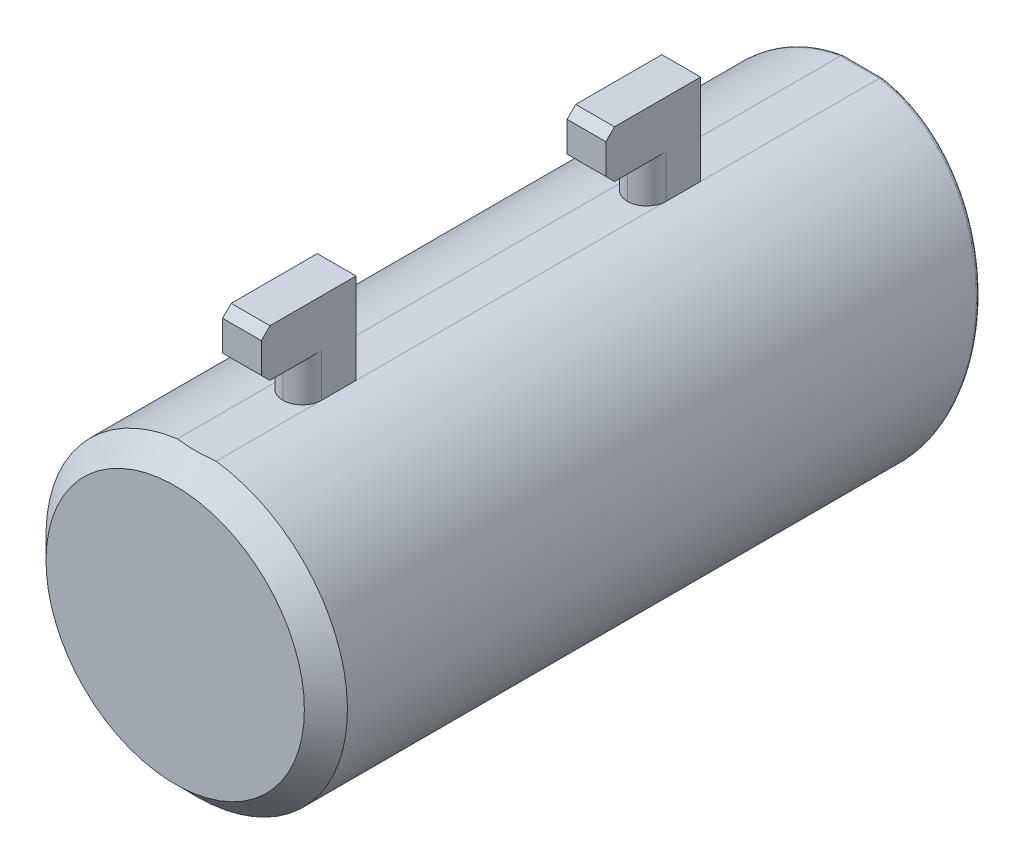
SolidWorks part; units mm, degrees
ref_plane "Спереди" through (0, 0, 0) normal (0, 0, 1) x (1, 0, 0)
ref_plane "Сверху" through (0, 0, 0) normal (0, 1, 0) x (1, 0, 0)
ref_plane "Справа" through (0, 0, 0) normal (1, 0, 0) x (0, 0, -1)
sketch "Эскиз2" plane through (0, 0, 0) normal (0, 0, 1) x (1, 0, 0)
  circle A0 centre (0, 0) radius 17.5
extrude "Бобышка-Вытянуть1" add sketch "Эскиз2" against normal blind 80
chamfer "Фаска1" distance 2.5 angle 45 1 edges at (17.5, 0, 0)
shell "Оболочка1" thickness 2.5
sketch "Эскиз12" plane through (0, 0, 0) normal (0, 0, 1) x (1, 0, 0)
  line L0 (-2.25, 17.3548) -> (2.25, 17.3548)
  arc A0 (2.25, 17.3548) -> (-2.25, 17.3548) centre (0, 0) ccw
  circle A1 centre (0, 0) radius 17.5 construction
extrude "Вырез-Вытянуть5" cut sketch "Эскиз12" against normal up to surface (80 mm away)
sketch "Эскиз11" plane through (0, 0, 0) normal (1, 0, 0) x (0, 0, -1)
  line L0 (70.6607, -17.5) -> (80, 17.3548)
  line L2 (80, 17.3548) -> (80, -17.5)
  line L3 (80, -17.5) -> (70.6607, -17.5)
extrude "Вырез-Вытянуть4" cut sketch "Эскиз11" against normal through all both and the other way through all
fillet "Скругление2" radius 0.4 3 edges at (0, -17.5, -70.6607) (0, -15, -71.3306) (0, 17.3548, -80)
sketch "Эскиз15" plane through (0, 0, 0) normal (1, 0, 0) x (0, 0, -1)
  line L0 (19.75, 17.3548) -> (12.5, 17.3548)
  line L1 (79.4787, 17.3548) -> (2.5, 17.3548) construction
  line L2 (12.5, 17.3548) -> (12.5, 22.3548)
  line L3 (12.5, 22.3548) -> (7.75, 22.3548)
  line L4 (7.75, 22.3548) -> (7.75, 27.8548)
  line L5 (7.75, 27.8548) -> (19.75, 27.8548)
  line L6 (19.75, 27.8548) -> (19.75, 17.3548)
  line L7 (0, 15) -> (0, -15) construction
  line L8 (73.9231, -5.3244) -> (80, 17.3548) construction
  line L9 (70.7401, -17.2035) -> (79.8651, 16.8512) construction
  line L10 (12.5, 17.3548) -> (80, 17.3548) construction
extrude "Бобышка-Вытянуть3" add sketch "Эскиз15" along normal mid plane 4.5
fillet "Скругление5" radius 2.25 2 edges at (2.25, 19.8548, -12.5) (-2.25, 19.8548, -12.5)
chamfer "Фаска2" distance 1 angle 45 5 edges at (0, 22.3548, -7.75) (0, 27.8548, -7.75) (2.25, 22.6048, -19.75) (0, 27.8548, -19.75) (-2.25, 22.6048, -19.75)
pattern_linear "Линейный массив2" count 2 spacing 40 along (0, 0, -1) of "Бобышка-Вытянуть3", "Скругление5", "Фаска2"
sketch "Эскиз16" [suppressed] plane through (0, 0, 0) normal (1, 0, 0) x (0, 0, -1)
  line L0 (75.3498, 0) -> (80, 17.3548)
  line L1 (70.7401, -17.2035) -> (79.8651, 16.8512) construction
  line L2 (52.5, 17.3548) -> (80, 17.3548)
  line L3 (12.5, 17.3548) -> (0, 17.3548) construction
  line L4 (0, 15) -> (0, -15) construction
  dimension "D1" = 27.5
  dimension "D2" = 12.5
  dimension "D3" = 40
equation "\"D1@Бобышка-Вытянуть1\" = \"Outside Height\""
equation "\"D1@Фаска1\"=\"Wall Thickness\""
equation "\"D1@Оболочка1\"= \"Wall Thickness\""
equation "\"Outside Height\"= ( \"Between Mounts\" * ( \"Number rows\" - 1 ) ) + ( \"Between Mounts\" / 2 ) * 2'Dont touch"
equation "\"Wall Thickness\"= 2.5мм"
equation "\"Outside Diameter\"= \"Inside Diameter\" + \"Wall Thickness\" * 2'Dont touch"
equation "\"Number rows\" = 2"
equation "\"Between Mounts\"= 40мм'Don't touch"
equation "\"Length between edge and axis mount\"= ( \"D1@Бобышка-Вытянуть1\" - ( \"Number rows\" - 1 ) * \"Between Mounts\" / 2 ) / 2'Dont touch"
equation "\"Length Mount\"= 4.5мм'Dont touch"
equation "\"Height Mount\"= 12мм'Dont touch"
equation "\"D1@Скругление2\"=( \"Wall Thickness\" - 1.7 )*0.5"
equation "\"Chamfer\"= 1мм'Dont touch"
equation "\"D1@Эскиз11\" = 15градусов"
equation "\"D2@Эскиз2\" = \"Outside Diameter\" / 2"
equation "\"D1@Эскиз12\"=\"Length Mount\""
equation "\"D1@Эскиз15\"=7.25мм"
equation "\"D2@Эскиз15\"=12мм"
equation "\"D3@Эскиз15\"= 5.5мм"
equation "\"D4@Эскиз15\"=5мм + 5.5мм"
equation "\"D5@Эскиз15\"= 12.5мм"
equation "\"D1@Бобышка-Вытянуть3\" = \"D1@Эскиз12\""
equation "\"D1@Скругление5\"=\"Length Mount\"/2"
equation "\"D1@Фаска2\" = \"Chamfer\""
equation "\"D1@Линейный массив2\"=\"Number rows\""
equation "\"D3@Линейный массив2\"=\"Between Mounts\""
equation "\"Inside Diameter\" = 30мм"
equation "\"Линейный массив2\" = IIF ( \"Number rows\" = 1 , \"suppressed\" , \"unsuppressed\" )"
